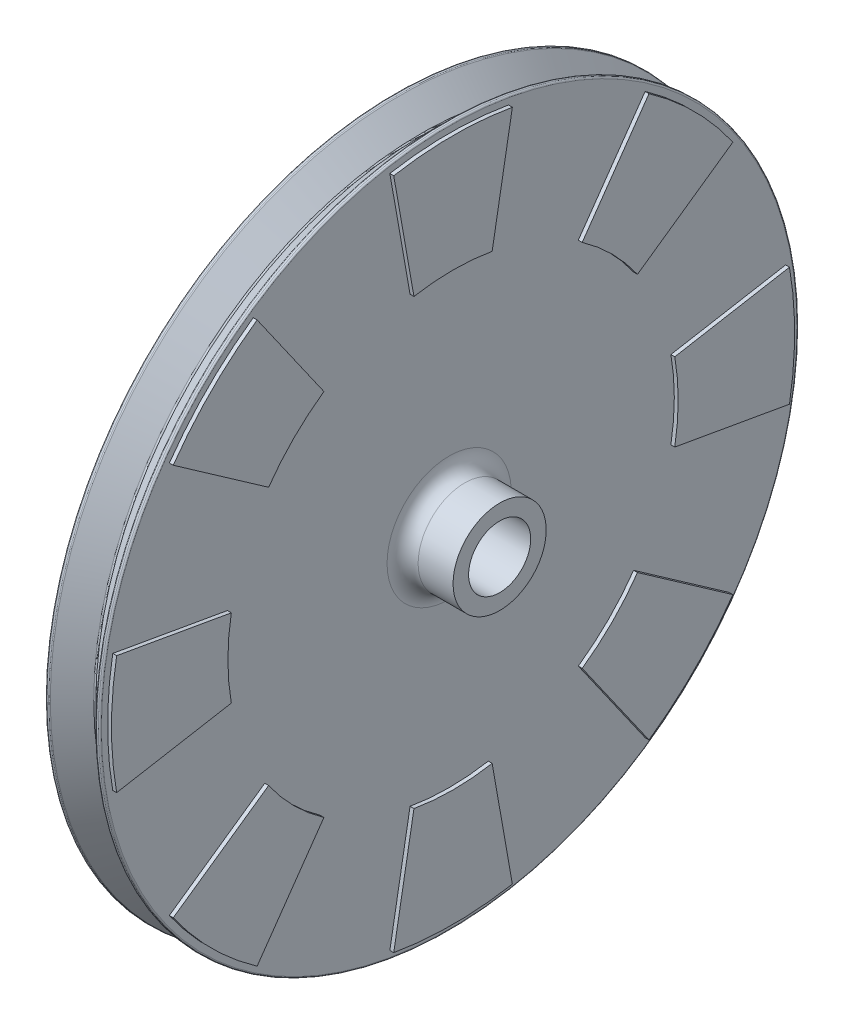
SolidWorks part; units mm, degrees
ref_plane "Face" through (0, 0, 0) normal (0, 0, 1) x (1, 0, 0)
ref_plane "Dessus" through (0, 0, 0) normal (0, 1, 0) x (1, 0, 0)
ref_plane "Droite" through (0, 0, 0) normal (1, 0, 0) x (0, 0, -1)
sketch "Esquisse1" plane through (0, 0, 0) normal (0, 0, 1) x (1, 0, 0)
  line L1 (-3, 45) -> (0, 42)
  line L2 (0, 0) -> (-3.5, 0)
  line L3 (3.5, 8) -> (3.5, 45)
  line L4 (3.5, 45) -> (3, 45)
  line L5 (-3.5, 0) -> (-3.5, 45)
  line L6 (0, 42) -> (3, 45)
  line L7 (-3, 45) -> (-3.5, 45)
  line L8 (5.5, 6) -> (10, 6)
  line L9 (10, 6) -> (10, 4)
  line L10 (10, 4) -> (0, 4)
  line L11 (0, 4) -> (0, 0)
  line L12 (0, 0) -> (68.6205, 0) construction
  arc A0 (3.5, 8) -> (5.5, 6) centre (5.5, 8) ccw
  dimension "D8" = 2
  dimension "D1" = 10
  dimension "D2" = 7
  dimension "D3" = 4
  dimension "D4" = 0.5
  dimension "D5" = 0.5
  dimension "D6" = 45
  dimension "D7" = 2
  dimension "D9" = 45
  dimension "D10" = 3.5
  dimension "D11" = 3.5
revolve "Révolution2" add sketch "Esquisse1" angle 360 about L12
sketch "Esquisse2" plane through (3.5, 0, 0) normal (1, 0, 0) x (0, 0, -1)
  line L0 (0, 0) -> (0, 48.3793) construction
  line L1 (5.0358, 28.5594) -> (7.6405, 43.3315)
  line L2 (-5.0358, 28.5594) -> (-7.6405, 43.3315)
  arc A0 (7.6405, 43.3315) -> (-7.6405, 43.3315) centre (0, 0) ccw
  arc A1 (5.0358, 28.5594) -> (-5.0358, 28.5594) centre (0, 0) ccw
  dimension "D2" = 44
  dimension "D1" = 20
  dimension "D3" = 15
extrude "Extrusion1" add sketch "Esquisse2" along normal blind 0.5
pattern_circular "Répétition circulaire1" count 8 over 360 about axis through (0, 0, 0) along (1, 0, 0) of "Extrusion1"
fillet "Congé1" radius 0.2 5 edges at (0, 0, 42) (-3, 0, 45) (-3.5, 0, 45) (3.5, 0, 45) (3, 0, 45)
sketch "Esquisse3" plane through (-3.5, 0, 0) normal (-1, 0, 0) x (0, 0, 1)
  circle A0 centre (-32.0177, 10.7616) radius 2.0238
extrude "Enlèv. mat.-Extru.1" cut sketch "Esquisse3" against normal blind 0.25
